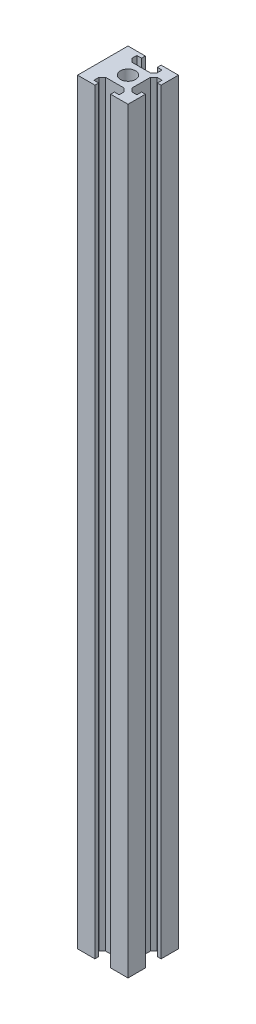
SolidWorks part; units mm, degrees
ref_plane "Ebene vorne" through (0, 0, 0) normal (0, 0, 1) x (1, 0, 0)
ref_plane "Ebene oben" through (0, 0, 0) normal (0, 1, 0) x (1, 0, 0)
ref_plane "Ebene rechts" through (0, 0, 0) normal (1, 0, 0) x (0, 0, -1)
sketch "Skizze1" plane through (0, 0, 0) normal (0, 1, 0) x (1, 0, 0)
  line L0 (0, 54.0679) -> (0, -54.0679) construction
  line L1 (-53.0666, 0) -> (53.0666, 0) construction
  line L2 (-3.125, 10) -> (-3.125, 8.5)
  line L3 (-10, 10) -> (-3.125, 10)
  line L4 (-10, 10) -> (-10, -10)
  line L5 (-10, -10) -> (-3.125, -10)
  line L6 (10, 10) -> (10, 3.125)
  line L7 (-3.125, 8.5) -> (-5, 8.5)
  line L8 (-5, 8.5) -> (-5, 6.5048)
  line L9 (-5, 6.5048) -> (-3.7072, 5.2)
  line L10 (-3.7072, 5.2) -> (3.7072, 5.2)
  line L11 (5, 6.5048) -> (3.7072, 5.2)
  line L12 (5, 8.5) -> (5, 6.5048)
  line L13 (3.125, 8.5) -> (5, 8.5)
  line L14 (3.125, 10) -> (3.125, 8.5)
  line L15 (10, 3.125) -> (8.5, 3.125)
  line L16 (8.5, 3.125) -> (8.5, 5)
  line L17 (8.5, 5) -> (6.5048, 5)
  line L18 (6.5048, 5) -> (5.2, 3.7072)
  line L19 (5.2, 3.7072) -> (5.2, -3.7072)
  line L20 (6.5048, -5) -> (5.2, -3.7072)
  line L21 (8.5, -5) -> (6.5048, -5)
  line L22 (8.5, -3.125) -> (8.5, -5)
  line L23 (10, -3.125) -> (8.5, -3.125)
  line L24 (54.0679, 0) -> (-54.0679, 0) construction
  line L25 (3.125, -10) -> (3.125, -8.5)
  line L26 (3.125, -8.5) -> (5, -8.5)
  line L27 (5, -8.5) -> (5, -6.5048)
  line L28 (5, -6.5048) -> (3.7072, -5.2)
  line L29 (3.7072, -5.2) -> (-3.7072, -5.2)
  line L30 (-5, -6.5048) -> (-3.7072, -5.2)
  line L31 (-5, -8.5) -> (-5, -6.5048)
  line L32 (-3.125, -8.5) -> (-5, -8.5)
  line L33 (-3.125, -10) -> (-3.125, -8.5)
  line L34 (0, -54.0679) -> (0, 54.0679) construction
  line L35 (3.125, 10) -> (10, 10)
  line L36 (10, -3.125) -> (10, -10)
  line L37 (3.125, -10) -> (10, -10)
  circle A0 centre (0, 0) radius 3
  point P19 (0, 5.2)
  point P34 (5.2, 0)
  point P47 (0, -5.2)
  point P51 (0, 0)
  dimension "D3" = 6
  dimension "D1" = 20
  dimension "D2" = 20
  dimension "D4" = 1.5
  dimension "D5" = 10
  dimension "D6" = 6.25
  dimension "D7" = 4.8
  dimension "D8" = 3
extrude "Aufsatz-Linear austragen1" add sketch "Skizze1" along normal blind 300
